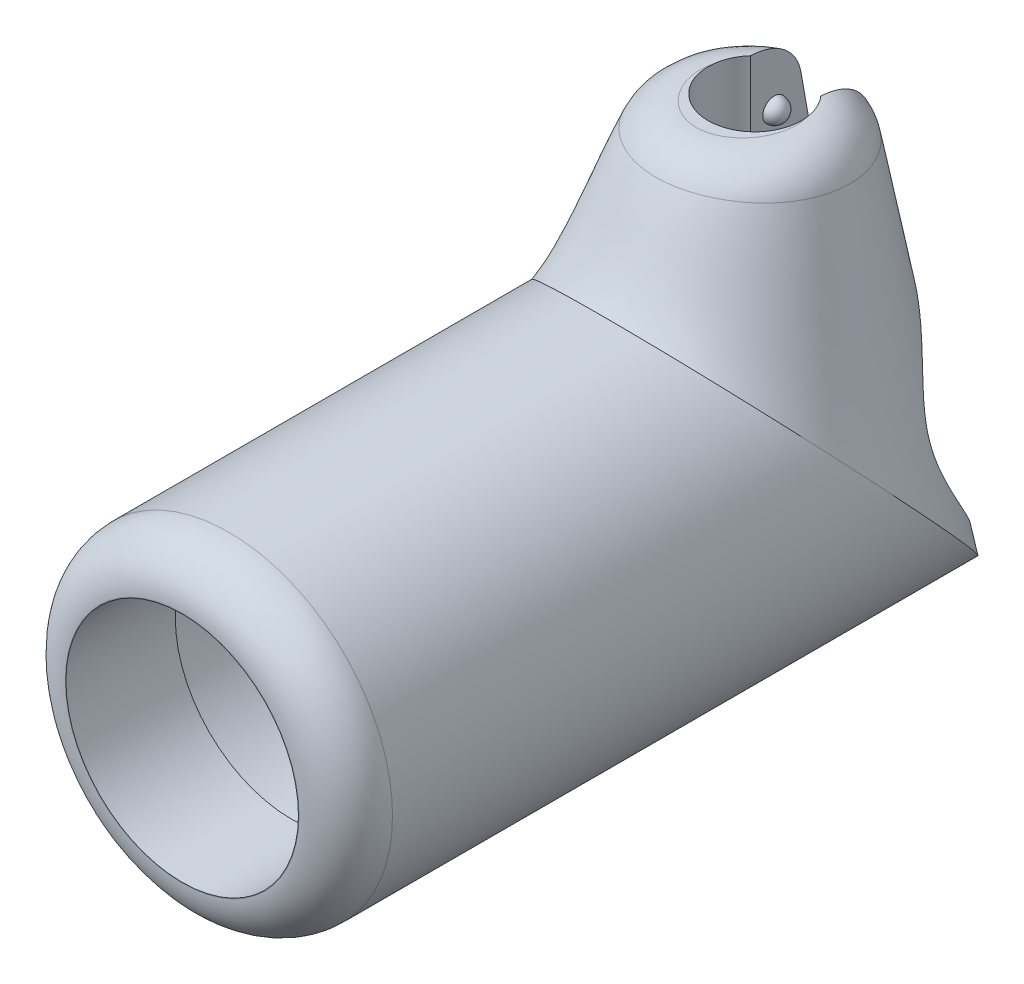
SolidWorks part; units mm, degrees
ref_plane "Alzado" through (0, 0, 0) normal (0, 0, 1) x (1, 0, 0)
ref_plane "Planta" through (0, 0, 0) normal (0, 1, 0) x (1, 0, 0)
ref_plane "Vista lateral" through (0, 0, 0) normal (1, 0, 0) x (0, 0, -1)
sketch "Croquis1" plane through (0, 0, 0) normal (0, 0, 1) x (1, 0, 0)
  circle A0 centre (0, 0) radius 7
  dimension "D1" = 14
extrude "Saliente-Extruir1" add sketch "Croquis1" against normal blind 31
sketch "Croquis2" plane through (0, 0, 0) normal (0, 0, 1) x (1, 0, 0)
  circle A0 centre (0, 0) radius 4.975
extrude "Cortar-Extruir1" cut sketch "Croquis2" against normal blind 4.68
sketch "Croquis3" plane through (0, 0, -4.68) normal (0, 0, 1) x (1, 0, 0)
  circle A0 centre (0, 0) radius 6.1
sketch "Croquis6" plane through (0, 0, 0) normal (1, 0, 0) x (0, 0, -1)
  line L0 (31, 7) -> (31, -7)
  line L1 (31, -7) -> (18, 7)
  line L2 (18, 7) -> (31, 7)
extrude "Cortar-Extruir3" cut sketch "Croquis6" against normal mid plane 40
sketch "Croquis7" plane through (0, 12.2164, -13.1562) normal (0, 0.6805, -0.7328) x (1, 0, 0)
  ellipse E1 centre (0, 16.6711) end of major axis (0, 7.1186) minor radius 7
  ellipse E2 centre (0, 16.6711) end of major axis (0, 7.1186) minor radius 7
  dimension "D1" = 0
ref_plane "Plano1" through (0, 12, 0) normal (0, 1, 0) x (1, 0, 0)
sketch "Croquis9" plane through (0, 12, 0) normal (0, 1, 0) x (1, 0, 0)
  circle A0 centre (0, 24.5) radius 3.5
sketch "Croquis12" plane through (0, 0, 0) normal (1, 0, 0) x (0, 0, -1)
  line L0 (28, 12) -> (31, -7)
  line L1 (28, 12) -> (21, 12) construction
  line L2 (7.22, 12) -> (-7.22, 12) construction
other "Límite1"
extrude "Cortar-Extruir4" cut sketch "Croquis3" against normal blind 40
sketch "Croquis13" plane through (0, 12, 0) normal (0, 1, 0) x (1, 0, 0)
  circle A0 centre (0, 24.5) radius 2
extrude "Cortar-Extruir5" cut sketch "Croquis13" against normal blind 12
fillet "Redondeo1" radius 2 2 edges at (7, 0, 0) (0, 12, -21)
sketch "Croquis14" plane through (0, 12, 0) normal (0, 1, 0) x (1, 0, 0)
  line L0 (0, 24.5) -> (1.5, 24.5)
  line L1 (0, 24.5) -> (-1.5, 24.5)
  line L2 (-1.5, 30.1062) -> (-1.5, 24.5)
  line L3 (-1.5, 30.1062) -> (1.5, 30.1062)
  line L4 (1.5, 30.1062) -> (1.5, 24.5)
extrude "Cortar-Extruir6" cut sketch "Croquis14" against normal blind 10
ref_plane "Plano2" through (0, 9.5, 0) normal (0, 1, 0) x (1, 0, 0)
sketch "Croquis16" plane through (0, 9.5, 0) normal (0, 1, 0) x (1, 0, 0)
  line L0 (-1.5, 26.3425) -> (-1.5, 26.8425)
  line L3 (-1.5, 28.7454) -> (-1.5, 25.8229) construction
  line L4 (-1.5, 26.8425) -> (-1, 26.8425)
  arc A0 (-1.5, 26.3425) -> (-1, 26.8425) centre (-1.5, 26.8425) ccw
revolve "Revolución1" add sketch "Croquis16" angle 360 about L4
ref_plane "Plano4" through (0, 7.3, 0) normal (0, 1, 0) x (1, 0, 0)
sketch "Croquis17" plane through (0, 7.3, 0) normal (0, 1, 0) x (1, 0, 0)
  line L0 (-1.5, 26.8425) -> (-1, 26.8425)
  line L1 (-1.5, 26.3425) -> (-1.5, 27.3425) construction
  line L2 (-1.5, 26.8425) -> (-1.5, 26.3425)
  line L3 (-1.5, 25.8229) -> (-1.5, 27.9733) construction
  arc A0 (-1.5, 26.3425) -> (-1.5, 27.3425) centre (-1.5, 26.8425) ccw construction
  arc A1 (-1.5, 26.3425) -> (-1, 26.8425) centre (-1.5, 26.8425) ccw
revolve "Revolución2" add sketch "Croquis17" angle 360 about L0
sketch "Croquis18" plane through (0, 7.3, 0) normal (0, 1, 0) x (1, 0, 0)
  line L1 (1.5, 27.9733) -> (1.5, 25.8229) construction
  line L2 (1.5, 26.3425) -> (1.5, 26.8425)
  line L3 (1.5, 26.8425) -> (1, 26.8425)
  arc A0 (1, 26.8425) -> (1.5, 26.3425) centre (1.5, 26.8425) ccw
revolve "Revolución3" add sketch "Croquis18" angle 360 about L3
sketch "Croquis19" plane through (0, 9.5, 0) normal (0, 1, 0) x (1, 0, 0)
  line L0 (1.5, 26.3425) -> (1.5, 26.8425)
  line L2 (1.5, 25.8229) -> (1.5, 28.7454) construction
  line L3 (1.5, 27.3425) -> (1.5, 26.3425) construction
  line L4 (1.5, 26.8425) -> (1, 26.8425)
  arc A1 (1.5, 27.3425) -> (1.5, 26.3425) centre (1.5, 26.8425) ccw construction
  arc A2 (1, 26.8425) -> (1.5, 26.3425) centre (1.5, 26.8425) ccw
revolve "Revolución4" add sketch "Croquis19" angle 360 about L4
